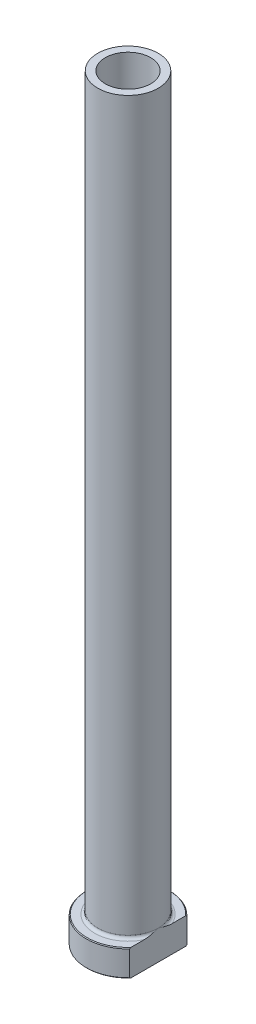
SolidWorks part; units mm, degrees
ref_plane "Front Plane" through (0, 0, 0) normal (0, 0, 1) x (1, 0, 0)
ref_plane "Top Plane" through (0, 0, 0) normal (0, 1, 0) x (1, 0, 0)
ref_plane "Right Plane" through (0, 0, 0) normal (1, 0, 0) x (0, 0, -1)
sketch "Sketch1" plane through (0, 0, 0) normal (0, 0, 1) x (1, 0, 0)
  line L0 (-6, 200) -> (-8, 200)
  line L1 (-8, 200) -> (-8, 7)
  line L2 (-8, 7) -> (-11, 7)
  line L3 (-11, 7) -> (-11, 0)
  line L4 (10.45, 0) -> (-10.45, 0) construction
  line L5 (-11, 0) -> (-6.25, 0)
  line L6 (-6, 145) -> (-6, 200)
  line L7 (0, 92.1877) -> (0, -15.5353) construction
  line L8 (0, -12.1) -> (0, 12.1) construction
  line L9 (-6, 145) -> (-6.25, 133)
  line L10 (-6.25, 133) -> (-6.25, 0)
  dimension "D1" = 0.25
  dimension "ID" = 12
  dimension "OD" = 16
  dimension "L" = 200
  dimension "H" = 22
  dimension "T" = 7
  dimension "N" = 55
  dimension "D2" = 12
  dimension "L-N" = 145
revolve "Revolve1" add sketch "Sketch1" angle 360 about L7
fillet "Fillet1" radius 0.8 1 edges at (0, 7, 8)
chamfer "Chamfer1" distance 0.2 angle 45 2 edges at (0, 7, 11) (0, 0, 11)
sketch "Sketch2" plane through (0, 0, 0) normal (0, -1, 0) x (1, 0, 0)
  line L0 (8, 7.5498) -> (8, -7.5498)
  circle A0 centre (0, 0) radius 11 construction
  arc A1 (8, 7.5498) -> (8, -7.5498) centre (0, 0) cw
  circle A2 centre (0, 0) radius 8 construction
extrude "Cut-Extrude1" cut sketch "Sketch2" against normal through all
chamfer "Chamfer2" distance 0.5 angle 45 1 edges at (0, 0, 6.25)
